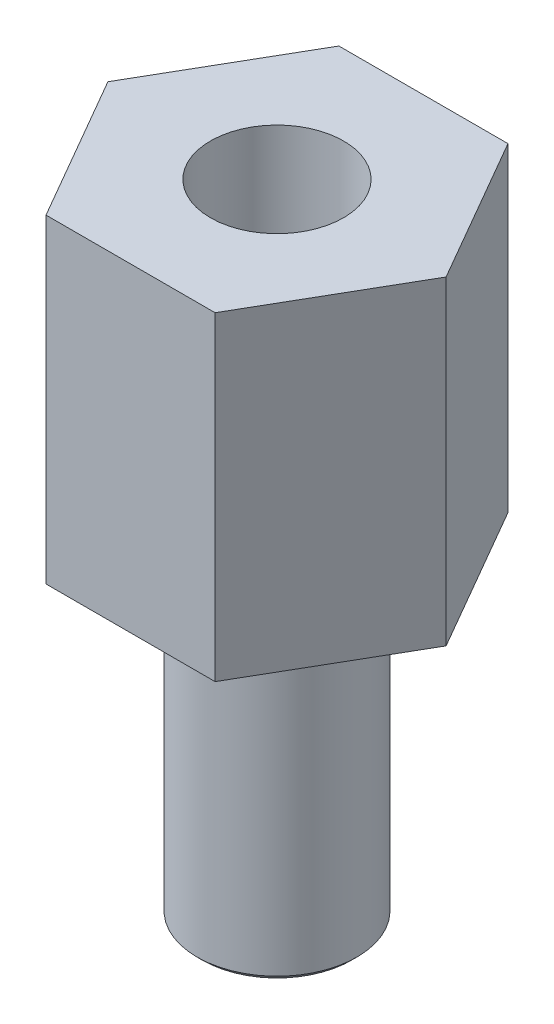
SolidWorks part; units mm, degrees
ref_plane "Спереди" through (0, 0, 0) normal (0, 0, 1) x (1, 0, 0)
ref_plane "Сверху" through (0, 0, 0) normal (0, 1, 0) x (1, 0, 0)
ref_plane "Справа" through (0, 0, 0) normal (1, 0, 0) x (0, 0, -1)
sketch "Эскиз1" plane through (0, 0, 0) normal (0, 1, 0) x (1, 0, 0)
  line L1 (3.1754, 0) -> (1.5877, 2.75)
  line L2 (1.5877, 2.75) -> (-1.5877, 2.75)
  line L3 (-1.5877, 2.75) -> (-3.1754, 0)
  line L4 (-3.1754, 0) -> (-1.5877, -2.75)
  line L5 (-1.5877, -2.75) -> (1.5877, -2.75)
  line L6 (1.5877, -2.75) -> (3.1754, 0)
  circle A0 centre (0, 0) radius 2.75 construction
  circle A1 centre (0, 0) radius 1.25
  dimension "D2" = 2.5
  dimension "D1" = 5.5
extrude "Бобышка-Вытянуть1" add sketch "Эскиз1" along normal blind 6
sketch "Эскиз2" plane through (0, 0, 0) normal (0, -1, 0) x (1, 0, 0)
  circle A0 centre (0, 0) radius 1.5
  dimension "D1" = 3
extrude "Бобышка-Вытянуть2" add sketch "Эскиз2" along normal blind 6
chamfer "Фаска1" distance 0.1 angle 45 1 edges at (0, -6, -1.5)
